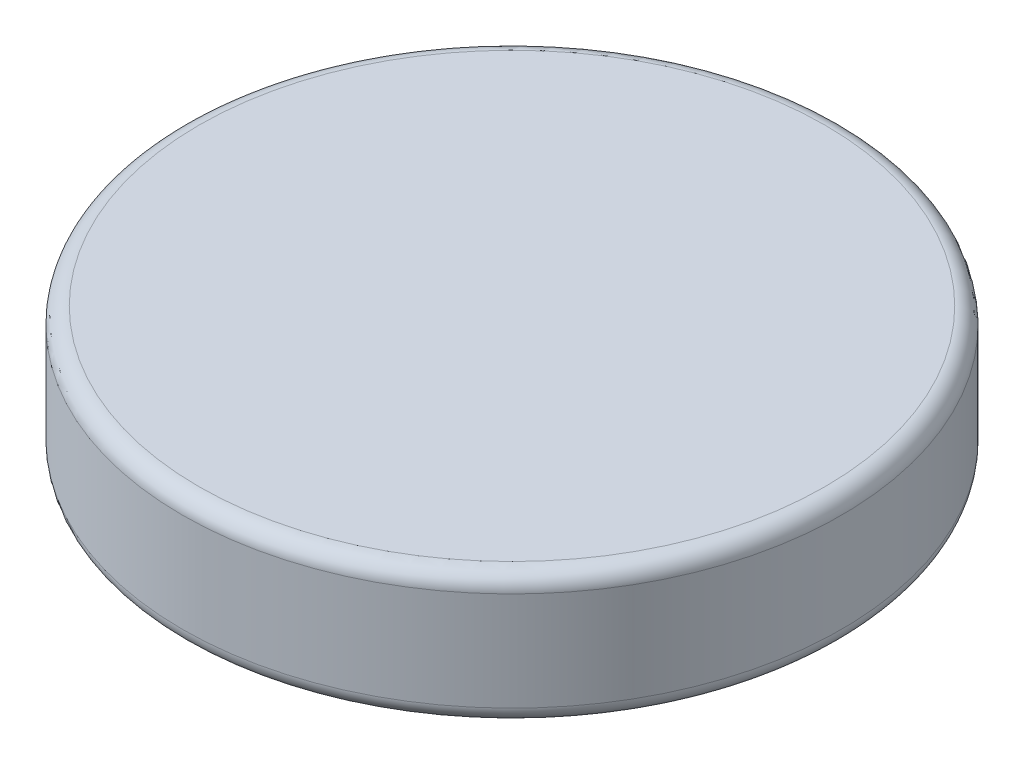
SolidWorks part; units mm, degrees
ref_plane "Piano frontale" through (0, 0, 0) normal (0, 0, 1) x (1, 0, 0)
ref_plane "Piano superiore" through (0, 0, 0) normal (0, 1, 0) x (1, 0, 0)
ref_plane "Piano destro" through (0, 0, 0) normal (1, 0, 0) x (0, 0, -1)
sketch "Schizzo1" plane through (0, 0, 0) normal (0, 1, 0) x (1, 0, 0)
  circle A0 centre (0, 0) radius 10
extrude "Estrusione-Estrusione1" add sketch "Schizzo1" along normal blind 4
fillet "Raccordo1" radius 0.5 1 edges at (0, 4, 10)
fillet "Raccordo2" radius 0.5 1 edges at (0, 0, 10)
